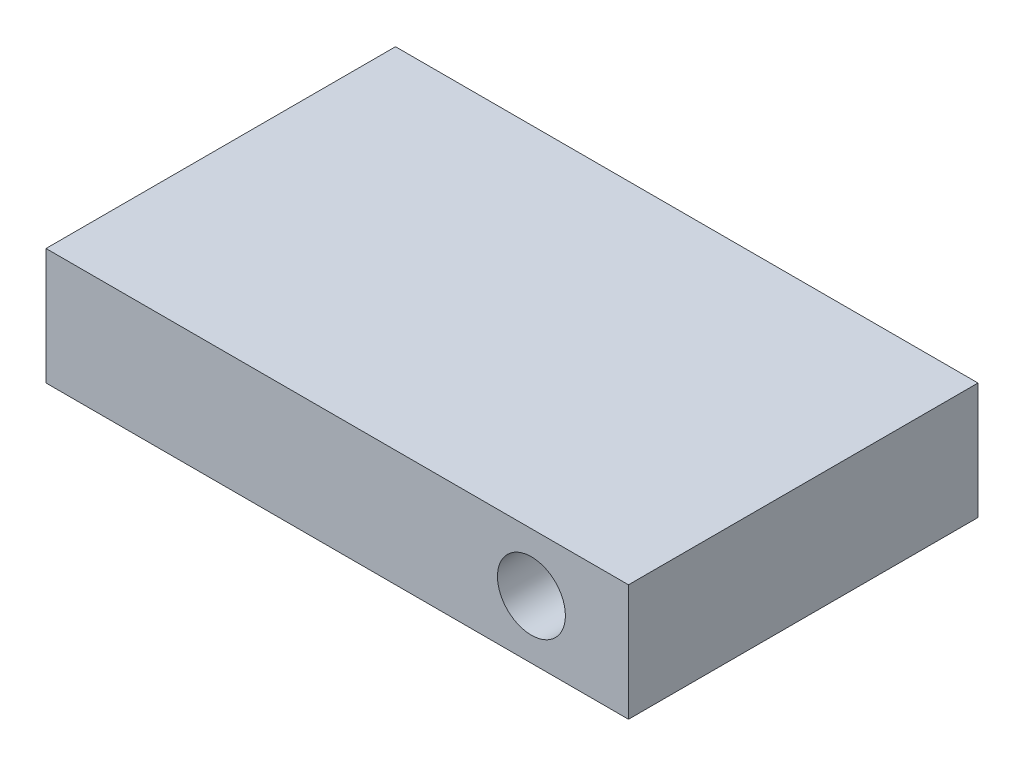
SolidWorks part; units mm, degrees
ref_plane "Front" through (0, 0, 0) normal (0, 0, 1) x (1, 0, 0)
ref_plane "Top" through (0, 0, 0) normal (0, 1, 0) x (1, 0, 0)
ref_plane "Right" through (0, 0, 0) normal (1, 0, 0) x (0, 0, -1)
sketch "Sketch1" plane through (0, 0, 0) normal (0, 1, 0) x (1, 0, 0)
  line L1 (0, 0) -> (30, 0)
  line L2 (0, 0) -> (0, 18)
  line L3 (0, 18) -> (30, 18)
  line L4 (30, 0) -> (30, 18)
  dimension "D1" = 30
  dimension "D2" = 18
extrude "Extrude1" add sketch "Sketch1" along normal blind 6
sketch "Sketch2" plane through (0, 0, 0) normal (0, 0, 1) x (1, 0, 0)
  circle A0 centre (25, 3) radius 1.75
extrude "Cut-Extrude1" cut sketch "Sketch2" against normal through all
